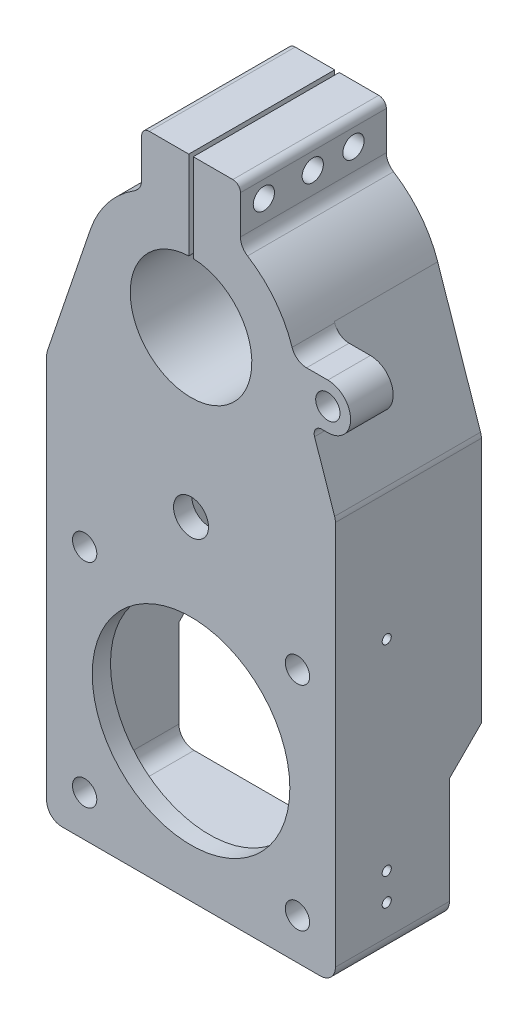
SolidWorks part; units mm, degrees
ref_plane "前视基准面" through (0, 0, 0) normal (0, 0, 1) x (1, 0, 0)
ref_plane "上视基准面" through (0, 0, 0) normal (0, 1, 0) x (1, 0, 0)
ref_plane "右视基准面" through (0, 0, 0) normal (1, 0, 0) x (0, 0, -1)
sketch "草图1" plane through (0, 0, 0) normal (0, 0, 1) x (1, 0, 0)
  line L0 (0, 0) -> (95, 0) construction
  line L1 (0, 0) -> (-70, 0) construction
  line L2 (-70, 0) -> (-70, -70) construction
  line L3 (0, 0) -> (0, 122) construction
  line L4 (0, 122) -> (0, 230) construction
  line L5 (0, 230) -> (90, 230) construction
  line L6 (95, 166.3473) -> (95, -87)
  line L7 (85, -97) -> (-85, -97)
  line L8 (-95, -87) -> (-95, 166.3473)
  line L9 (-94.4683, 169.5648) -> (-66.2778, 252.5224)
  line L10 (94.4683, 169.5648) -> (81.2743, 208.3913)
  line L11 (0, 230) -> (0, 328) construction
  line L12 (0, 328) -> (27.5, 328)
  line L13 (0, 328) -> (-27.5, 328)
  line L14 (-32.5, 323) -> (-32.5, 297.7772)
  line L15 (32.5, 323) -> (32.5, 297.7772)
  line L16 (90, 245) -> (75.9934, 245)
  line L17 (90, 215) -> (86.0084, 215)
  circle A0 centre (0, 0) radius 65
  circle A1 centre (-70, -70) radius 8
  circle A2 centre (0, 122) radius 11.5
  circle A3 centre (0, 230) radius 40
  arc A4 (90, 215) -> (90, 245) centre (90, 230) ccw
  circle A5 centre (90, 230) radius 8
  circle A6 centre (-70, 70) radius 8
  circle A7 centre (70, -70) radius 8
  circle A8 centre (70, 70) radius 8
  arc A9 (-37.1875, 289.3051) -> (-66.2778, 252.5224) centre (0, 230) ccw
  arc A10 (94.4683, 169.5648) -> (95, 166.3473) centre (85, 166.3473) cw
  arc A11 (-94.4683, 169.5648) -> (-95, 166.3473) centre (-85, 166.3473) ccw
  arc A12 (95, -87) -> (85, -97) centre (85, -87) cw
  arc A13 (-95, -87) -> (-85, -97) centre (-85, -87) ccw
  arc A14 (66.4942, 251.875) -> (37.1875, 289.3051) centre (0, 230) ccw
  arc A15 (66.4942, 251.875) -> (75.9934, 245) centre (75.9934, 255) ccw
  arc A16 (32.5, 297.7772) -> (37.1875, 289.3051) centre (42.5, 297.7772) ccw
  arc A17 (-32.5, 297.7772) -> (-37.1875, 289.3051) centre (-42.5, 297.7772) cw
  arc A18 (86.0084, 215) -> (81.2743, 208.3913) centre (86.0084, 210) ccw
  arc A19 (27.5, 328) -> (32.5, 323) centre (27.5, 323) cw
  arc A20 (-27.5, 328) -> (-32.5, 323) centre (-27.5, 323) ccw
  dimension "D1" = 10
  dimension "D2" = 10
  dimension "D3" = 5
extrude "凸台-拉伸1" add sketch "草图1" along normal blind 28
sketch "草图2" plane through (0, 0, 0) normal (0, 0, -1) x (-1, 0, 0)
  line L0 (85, -97) -> (-85, -97) construction
  line L1 (95, 166.3473) -> (95, -87) construction
  line L2 (66.2778, 252.5224) -> (94.4683, 169.5648) construction
  line L3 (32.5, 323) -> (32.5, 297.7772) construction
  line L4 (-32.5, 297.7772) -> (-32.5, 323) construction
  line L5 (-27.5, 328) -> (27.5, 328) construction
  line L6 (85, -97) -> (-85, -97)
  line L7 (95, 166.3473) -> (95, -87)
  line L8 (66.2778, 252.5224) -> (94.4683, 169.5648)
  line L9 (32.5, 323) -> (32.5, 297.7772)
  line L10 (-32.5, 297.7772) -> (-32.5, 323)
  line L11 (-27.5, 328) -> (27.5, 328)
  line L12 (0, 0) -> (0, 230) construction
  line L13 (-66.2778, 252.5224) -> (-94.4683, 169.5648)
  line L14 (-95, 166.3473) -> (-95, -87)
  circle A0 centre (0, 0) radius 65 construction
  circle A1 centre (70, -70) radius 8 construction
  circle A2 centre (70, 70) radius 8 construction
  circle A3 centre (0, 122) radius 11.5 construction
  circle A4 centre (-70, 70) radius 8 construction
  circle A5 centre (-70, -70) radius 8 construction
  arc A6 (-95, -87) -> (-85, -97) centre (-85, -87) ccw construction
  arc A7 (85, -97) -> (95, -87) centre (85, -87) ccw construction
  arc A8 (95, 166.3473) -> (94.4683, 169.5648) centre (85, 166.3473) ccw construction
  circle A9 centre (0, 230) radius 40 construction
  arc A10 (66.2778, 252.5224) -> (37.1875, 289.3051) centre (0, 230) ccw construction
  arc A11 (32.5, 297.7772) -> (37.1875, 289.3051) centre (42.5, 297.7772) ccw construction
  arc A12 (32.5, 323) -> (27.5, 328) centre (27.5, 323) ccw construction
  arc A13 (-37.1875, 289.3051) -> (-32.5, 297.7772) centre (-42.5, 297.7772) ccw construction
  arc A14 (-27.5, 328) -> (-32.5, 323) centre (-27.5, 323) ccw construction
  circle A15 centre (0, 0) radius 65
  circle A16 centre (70, -70) radius 8
  circle A17 centre (70, 70) radius 8
  circle A18 centre (0, 122) radius 11.5
  circle A19 centre (-70, 70) radius 8
  circle A20 centre (-70, -70) radius 8
  arc A21 (-95, -87) -> (-85, -97) centre (-85, -87) ccw
  arc A22 (85, -97) -> (95, -87) centre (85, -87) ccw
  arc A23 (95, 166.3473) -> (94.4683, 169.5648) centre (85, 166.3473) ccw
  circle A24 centre (0, 230) radius 40
  arc A25 (66.2778, 252.5224) -> (37.1875, 289.3051) centre (0, 230) ccw
  arc A26 (32.5, 297.7772) -> (37.1875, 289.3051) centre (42.5, 297.7772) ccw
  arc A27 (32.5, 323) -> (27.5, 328) centre (27.5, 323) ccw
  arc A28 (-37.1875, 289.3051) -> (-32.5, 297.7772) centre (-42.5, 297.7772) ccw
  arc A29 (-27.5, 328) -> (-32.5, 323) centre (-27.5, 323) ccw
  arc A30 (-66.2778, 252.5224) -> (-37.1875, 289.3051) centre (0, 230) cw
  arc A31 (-95, 166.3473) -> (-94.4683, 169.5648) centre (-85, 166.3473) cw
extrude "凸台-拉伸2" add sketch "草图2" along normal blind 68
sketch "草图3" plane through (0, 0, -68) normal (0, 0, -1) x (-1, 0, 0)
  line L0 (0, 0) -> (83, 0) construction
  line L1 (83, 172.5571) -> (83, -75)
  line L2 (73, -85) -> (-73, -85)
  line L3 (-83, -75) -> (-83, 172.5571)
  line L4 (0, 0) -> (0, 172.1906) construction
  line L5 (-82.2249, 177.3167) -> (-80.7204, 181.813)
  line L6 (82.2249, 177.3167) -> (80.7204, 181.813)
  arc A0 (-54.761, 186.3969) -> (54.761, 186.3969) centre (0, 230) ccw
  arc A1 (80.7204, 181.813) -> (54.761, 186.3969) centre (66.4956, 177.0534) ccw
  arc A2 (-54.761, 186.3969) -> (-80.7204, 181.813) centre (-66.4956, 177.0534) ccw
  arc A3 (82.2249, 177.3167) -> (83, 172.5571) centre (68, 172.5571) cw
  arc A4 (-82.2249, 177.3167) -> (-83, 172.5571) centre (-68, 172.5571) ccw
  arc A5 (83, -75) -> (73, -85) centre (73, -75) cw
  arc A6 (-83, -75) -> (-73, -85) centre (-73, -75) ccw
  dimension "D1" = 15
  dimension "D2" = 15
  dimension "D3" = 10
extrude "切除-拉伸2" cut sketch "草图3" against normal blind 84
sketch "草图4" plane through (0, 328, 0) normal (0, 1, 0) x (1, 0, 0)
  line L1 (1.5, 81.537) -> (-1.5, 81.537)
  line L2 (1.5, 81.537) -> (1.5, -81.537)
  line L3 (1.5, -81.537) -> (-1.5, -81.537)
  line L4 (-1.5, 81.537) -> (-1.5, -81.537)
  line L5 (1.5, 81.537) -> (-1.5, -81.537) construction
  line L6 (1.5, -81.537) -> (-1.5, 81.537) construction
  point P0 (0, 0)
  dimension "D1" = 3
extrude "切除-拉伸3" cut sketch "草图4" against normal blind 84
sketch "草图5" plane through (32.5, 0, 0) normal (1, 0, 0) x (0, 0, -1)
  line L0 (-28, 328) -> (68, 328) construction
  circle A0 centre (19.58, 312) radius 7
  circle A1 centre (-12.5833, 312) radius 7
  circle A2 centre (46.3821, 312) radius 7
  dimension "D1" = 16
  dimension "D2" = 16
  dimension "D3" = 16
extrude "切除-拉伸4" cut sketch "草图5" against normal blind 10
sketch "草图6" plane through (95, 0, 0) normal (1, 0, 0) x (0, 0, -1)
  line L0 (-28, -97) -> (68, -97) construction
  line L1 (47, -97) -> (68, -97)
  line L2 (68, -97) -> (68, -17) construction
  line L3 (68, 166.3473) -> (68, -87) construction
  line L4 (68, -17) -> (47, -17) construction
  line L5 (47, -17) -> (68, 4)
  line L6 (68, 4) -> (68, -97)
  line L7 (47, -17) -> (47, -97)
extrude "切除-拉伸5" cut sketch "草图6" against normal blind 190
sketch "草图7" plane through (95, 0, 0) normal (1, 0, 0) x (0, 0, -1)
  line L0 (-28, -97) -> (47, -97) construction
  circle A0 centre (5.7449, -67) radius 3
  circle A1 centre (5.7449, -49) radius 3
  circle A2 centre (5.7449, 83) radius 3
  dimension "D1" = 30
  dimension "D2" = 18
  dimension "D3" = 150
extrude "切除-拉伸6" cut sketch "草图7" against normal blind 12
sketch "草图8" plane through (-136.3448, 46.3324, 0) normal (-0.9468, 0.3217, 0) x (0, 0, 1)
  line L0 (28, 217.7698) -> (28, 130.1532) construction
  circle A0 centre (-2, 183.1285) radius 2.5
  circle A1 centre (-2, 161.1285) radius 2.5
  dimension "D1" = 22
  dimension "D2" = 30
extrude "切除-拉伸7" cut sketch "草图8" against normal blind 12
